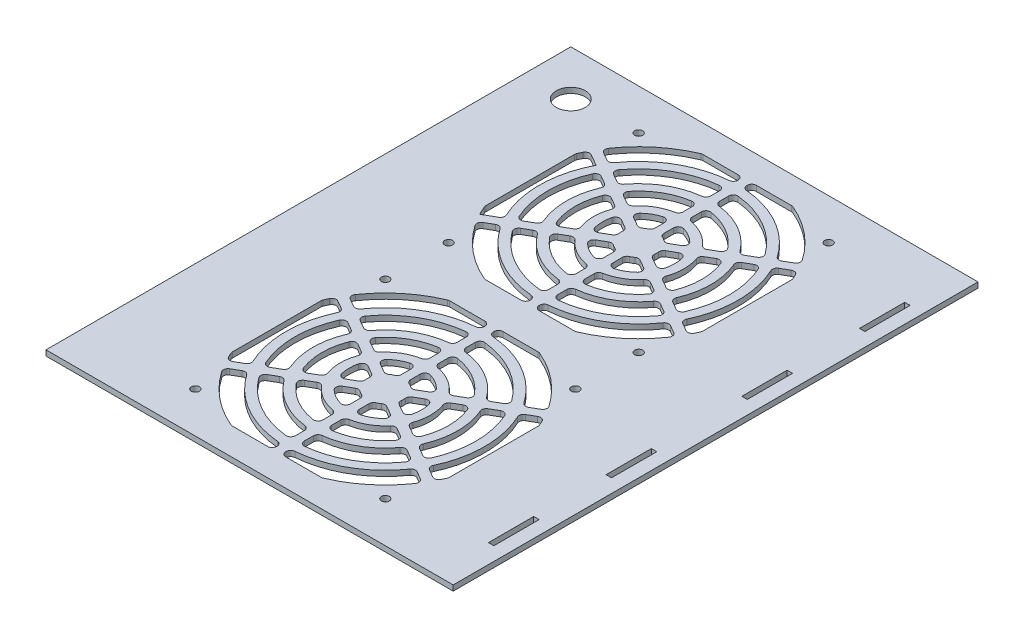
SolidWorks part; units mm, degrees
ref_plane "Front Plane" through (0, 0, 0) normal (0, 0, 1) x (1, 0, 0)
ref_plane "Top Plane" through (0, 0, 0) normal (0, 1, 0) x (1, 0, 0)
ref_plane "Right Plane" through (0, 0, 0) normal (1, 0, 0) x (0, 0, -1)
sketch "Sketch1" plane through (0, 0, 0) normal (0, 1, 0) x (1, 0, 0)
  line L0 (0, 0) -> (0, 290)
  line L1 (0, 290) -> (245, 290)
  line L2 (245, 290) -> (245, 0)
  line L3 (245, 0) -> (0, 0)
extrude "Boss-Extrude1" add sketch "Sketch1" along normal blind 3
sketch "Sketch2" plane through (0, 3, 0) normal (0, 1, 0) x (1, 0, 0)
  line L0 (245, 290) -> (227.5, 290) construction
  line L1 (245, 290) -> (0, 290) construction
  line L2 (227.5, 290) -> (227.5, 260) construction
  line L3 (227.5, 260) -> (227.5, 235) construction
  line L4 (227.5, 235) -> (227.5, 195) construction
  line L5 (227.5, 195) -> (227.5, 170) construction
  line L6 (227.5, 170) -> (227.5, 120) construction
  line L7 (227.5, 120) -> (227.5, 95) construction
  line L8 (227.5, 95) -> (227.5, 55) construction
  line L9 (227.5, 55) -> (227.5, 30) construction
  line L10 (227.5, 30) -> (227.5, 0) construction
  line L11 (0, 0) -> (245, 0) construction
  line L12 (227.5, 260) -> (227.5, 235)
  line L13 (227.5, 235) -> (224.5, 235)
  line L14 (224.5, 235) -> (224.5, 260)
  line L15 (224.5, 260) -> (227.5, 260)
  line L16 (227.5, 195) -> (227.5, 170)
  line L17 (227.5, 170) -> (224.5, 170)
  line L18 (224.5, 170) -> (224.5, 195)
  line L19 (224.5, 195) -> (227.5, 195)
  line L20 (227.5, 120) -> (227.5, 95)
  line L21 (227.5, 95) -> (224.5, 95)
  line L22 (224.5, 95) -> (224.5, 120)
  line L23 (224.5, 120) -> (227.5, 120)
  line L24 (227.5, 30) -> (227.5, 55)
  line L25 (227.5, 55) -> (224.5, 55)
  line L26 (224.5, 55) -> (224.5, 30)
  line L27 (224.5, 30) -> (227.5, 30)
  line L28 (245, 290) -> (235, 290)
  line L29 (235, 290) -> (235, 0)
  line L30 (235, 0) -> (245, 0)
  line L31 (245, 0) -> (245, 290)
  dimension "D1" = 30
  dimension "D2" = 25
  dimension "D3" = 40
  dimension "D4" = 25
  dimension "D5" = 50
  dimension "D6" = 25
  dimension "D7" = 40
  dimension "D8" = 25
extrude "Cut-Extrude1" cut sketch "Sketch2" against normal blind 3
sketch "Sketch4" plane through (0, 3, 0) normal (0, 1, 0) x (1, 0, 0)
  line L0 (0, 290) -> (10, 290)
  line L1 (235, 290) -> (0, 290) construction
  line L2 (10, 290) -> (10, 0)
  line L3 (0, 0) -> (235, 0) construction
  line L4 (10, 0) -> (0, 0)
  line L5 (0, 0) -> (0, 290)
extrude "Cut-Extrude2" cut sketch "Sketch4" against normal blind 10
sketch "Sketch5" plane through (0, 3, 0) normal (0, 1, 0) x (1, 0, 0)
  line L0 (10, 145) -> (235, 145) construction
  line L1 (10, 0) -> (10, 290) construction
  line L2 (235, 290) -> (235, 0) construction
  line L3 (122.5, 135) -> (122.5, 155) construction
  line L4 (122.5, 145) -> (122.5, 135) construction
  line L5 (97.5, 275) -> (147.5, 275)
  line L6 (182.5, 240) -> (182.5, 190)
  line L7 (97.5, 155) -> (147.5, 155)
  line L8 (62.5, 190) -> (62.5, 240)
  line L9 (122.5, 215) -> (122.5, 285.0061) construction
  line L10 (122.5, 155) -> (62.5, 155) construction
  line L11 (62.5, 155) -> (62.5, 275) construction
  line L12 (62.5, 275) -> (182.5, 275) construction
  line L13 (182.5, 275) -> (182.5, 155) construction
  line L14 (182.5, 155) -> (122.5, 155) construction
  line L15 (62.5, 275) -> (70, 275) construction
  line L16 (70, 275) -> (70, 267.5) construction
  line L17 (182.5, 275) -> (182.5, 267.5) construction
  line L18 (182.5, 267.5) -> (175, 267.5) construction
  line L19 (182.5, 155) -> (175, 155) construction
  line L20 (175, 155) -> (175, 162.5) construction
  line L21 (62.5, 155) -> (70, 155) construction
  line L22 (70, 155) -> (70, 162.5) construction
  line L23 (122.5, 285.0061) -> (125, 285.0061)
  line L24 (125, 285.0061) -> (125, 223.0061)
  line L25 (125, 223.0061) -> (122.5, 223.0061)
  line L26 (122.5, 223.0061) -> (120, 223.0061)
  line L27 (120, 223.0061) -> (120, 285.0061)
  line L28 (120, 285.0061) -> (122.5, 285.0061)
  line L29 (183.127, 250.003) -> (184.377, 247.838)
  line L30 (181.877, 252.1681) -> (183.127, 250.003)
  line L31 (128.1835, 221.1681) -> (181.877, 252.1681)
  line L32 (184.377, 247.838) -> (130.6835, 216.838)
  line L33 (175, 162.5) -> (70, 267.5) construction
  line L34 (70, 162.5) -> (175, 267.5) construction
  line L35 (130.6835, 216.838) -> (129.4335, 219.003)
  line L36 (129.4335, 219.003) -> (128.1835, 221.1681)
  line L37 (183.127, 179.997) -> (181.877, 177.8319)
  line L38 (184.377, 182.162) -> (183.127, 179.997)
  line L39 (130.6835, 213.162) -> (184.377, 182.162)
  line L40 (181.877, 177.8319) -> (128.1835, 208.8319)
  line L41 (128.1835, 208.8319) -> (129.4335, 210.997)
  line L42 (129.4335, 210.997) -> (130.6835, 213.162)
  line L43 (122.5, 144.9939) -> (120, 144.9939)
  line L44 (125, 144.9939) -> (122.5, 144.9939)
  line L45 (125, 206.9939) -> (125, 144.9939)
  line L46 (120, 144.9939) -> (120, 206.9939)
  line L47 (120, 206.9939) -> (122.5, 206.9939)
  line L48 (122.5, 206.9939) -> (125, 206.9939)
  line L49 (61.873, 179.997) -> (60.623, 182.162)
  line L50 (63.123, 177.8319) -> (61.873, 179.997)
  line L51 (116.8165, 208.8319) -> (63.123, 177.8319)
  line L52 (60.623, 182.162) -> (114.3165, 213.162)
  line L53 (114.3165, 213.162) -> (115.5665, 210.997)
  line L54 (115.5665, 210.997) -> (116.8165, 208.8319)
  line L55 (61.873, 250.003) -> (63.123, 252.1681)
  line L56 (60.623, 247.838) -> (61.873, 250.003)
  line L57 (114.3165, 216.838) -> (60.623, 247.838)
  line L58 (63.123, 252.1681) -> (116.8165, 221.1681)
  line L59 (116.8165, 221.1681) -> (115.5665, 219.003)
  line L60 (115.5665, 219.003) -> (114.3165, 216.838)
  line L61 (70, 127.5) -> (175, 22.5) construction
  line L62 (175, 127.5) -> (70, 22.5) construction
  line L63 (70, 135) -> (70, 127.5) construction
  line L64 (62.5, 135) -> (70, 135) construction
  line L65 (175, 135) -> (175, 127.5) construction
  line L66 (182.5, 135) -> (175, 135) construction
  line L67 (182.5, 22.5) -> (175, 22.5) construction
  line L68 (182.5, 15) -> (182.5, 22.5) construction
  line L69 (70, 15) -> (70, 22.5) construction
  line L70 (62.5, 15) -> (70, 15) construction
  line L71 (182.5, 135) -> (122.5, 135) construction
  line L72 (182.5, 15) -> (182.5, 135) construction
  line L73 (62.5, 15) -> (182.5, 15) construction
  line L74 (62.5, 135) -> (62.5, 15) construction
  line L75 (122.5, 135) -> (62.5, 135) construction
  line L76 (122.5, 75) -> (122.5, 4.9939) construction
  line L77 (115.5665, 70.997) -> (114.3165, 73.162)
  line L78 (116.8165, 68.8319) -> (115.5665, 70.997)
  line L79 (63.123, 37.8319) -> (116.8165, 68.8319)
  line L80 (114.3165, 73.162) -> (60.623, 42.162)
  line L81 (60.623, 42.162) -> (61.873, 39.997)
  line L82 (61.873, 39.997) -> (63.123, 37.8319)
  line L83 (115.5665, 79.003) -> (116.8165, 81.1681)
  line L84 (114.3165, 76.838) -> (115.5665, 79.003)
  line L85 (60.623, 107.838) -> (114.3165, 76.838)
  line L86 (116.8165, 81.1681) -> (63.123, 112.1681)
  line L87 (63.123, 112.1681) -> (61.873, 110.003)
  line L88 (61.873, 110.003) -> (60.623, 107.838)
  line L89 (122.5, 83.0061) -> (125, 83.0061)
  line L90 (120, 83.0061) -> (122.5, 83.0061)
  line L91 (120, 145.0061) -> (120, 83.0061)
  line L92 (125, 83.0061) -> (125, 145.0061)
  line L93 (125, 145.0061) -> (122.5, 145.0061)
  line L94 (122.5, 145.0061) -> (120, 145.0061)
  line L95 (129.4335, 79.003) -> (130.6835, 76.838)
  line L96 (128.1835, 81.1681) -> (129.4335, 79.003)
  line L97 (181.877, 112.1681) -> (128.1835, 81.1681)
  line L98 (130.6835, 76.838) -> (184.377, 107.838)
  line L99 (184.377, 107.838) -> (183.127, 110.003)
  line L100 (183.127, 110.003) -> (181.877, 112.1681)
  line L101 (129.4335, 70.997) -> (128.1835, 68.8319)
  line L102 (130.6835, 73.162) -> (129.4335, 70.997)
  line L103 (184.377, 42.162) -> (130.6835, 73.162)
  line L104 (128.1835, 68.8319) -> (181.877, 37.8319)
  line L105 (181.877, 37.8319) -> (183.127, 39.997)
  line L106 (183.127, 39.997) -> (184.377, 42.162)
  line L107 (120, 4.9939) -> (122.5, 4.9939)
  line L108 (120, 66.9939) -> (120, 4.9939)
  line L109 (122.5, 66.9939) -> (120, 66.9939)
  line L110 (125, 66.9939) -> (122.5, 66.9939)
  line L111 (125, 4.9939) -> (125, 66.9939)
  line L112 (122.5, 4.9939) -> (125, 4.9939)
  line L113 (62.5, 100) -> (62.5, 50)
  line L114 (97.5, 135) -> (147.5, 135)
  line L115 (182.5, 50) -> (182.5, 100)
  line L116 (97.5, 15) -> (147.5, 15)
  circle A0 centre (70, 162.5) radius 2.2
  circle A1 centre (175, 162.5) radius 2.2
  circle A2 centre (175, 267.5) radius 2.2
  circle A3 centre (70, 267.5) radius 2.2
  circle A10 centre (122.5, 215) radius 10
  circle A11 centre (122.5, 215) radius 20
  circle A12 centre (122.5, 215) radius 25
  circle A13 centre (122.5, 215) radius 35
  circle A15 centre (122.5, 215) radius 40
  circle A16 centre (122.5, 215) radius 50
  circle A18 centre (122.5, 215) radius 55
  circle A20 centre (122.5, 215) radius 65
  circle A21 centre (122.5, 75) radius 65
  circle A22 centre (122.5, 75) radius 55
  circle A23 centre (122.5, 75) radius 50
  circle A24 centre (122.5, 75) radius 40
  circle A25 centre (122.5, 75) radius 35
  circle A26 centre (122.5, 75) radius 25
  circle A27 centre (122.5, 75) radius 20
  circle A28 centre (122.5, 75) radius 10
  circle A29 centre (70, 22.5) radius 2.2
  circle A30 centre (175, 22.5) radius 2.2
  circle A31 centre (175, 127.5) radius 2.2
  circle A32 centre (70, 127.5) radius 2.2
  point P81 (122.5, 215)
  dimension "D1" = 6
extrude "Cut-Extrude3" cut sketch "Sketch5" against normal blind 10 contours L5 A20 L58 A18 L27 | L31 A20 L5 L24 A18 | L39 A20 L6 L32 A18 | L7 A20 L40 A18 L45 | L51 A20 L7 L46 A18 | L57 A20 L8 L52 A18 | L57 A16 L52 A15 | L27 A16 L58 A15 | L31 A16 L24 A15 | L39 A16 L32 A15 | L45 A16 L40 A15 | L51 A16 L46 A15 | L51 A13 L46 A12 | L51 A11 L46 A10 | L57 A11 L52 A10 | L27 A13 L58 A12 | L57 A13 L52 A12 | L31 A13 L24 A12 | L39 A13 L32 A12 | L45 A13 L40 A12 | L45 A11 L40 A10 | L31 A11 L24 A10 | L27 A11 L58 A10 | L39 A11 L32 A10 | A1 | A0 | A3 | A2 | L86 A22 L91 L114 A21 | L92 A22 L97 A21 L114 | L98 A22 L103 A21 L115 | L104 A22 L111 L116 A21 | L108 A22 L79 A21 L116 | L80 A22 L85 A21 L113 | L80 A24 L85 A23 | L86 A24 L91 A23 | L92 A24 L97 A23 | L98 A24 L103 A23 | L104 A24 L111 A23 | L108 A24 L79 A23 | L108 A26 L79 A25 | L104 A26 L111 A25 | L92 A26 L97 A25 | L98 A26 L103 A25 | L86 A26 L91 A25 | L80 A26 L85 A25 | L86 A28 L91 A27 | L80 A28 L85 A27 | L108 A28 L79 A27 | L104 A28 L111 A27 | L98 A28 L103 A27 | L92 A28 L97 A27 | A32 | A31 | A30 | A29
fillet "Fillet1" radius 2.5 98 edges at (120, 1.5, -160.0568) (120, 1.5, -155) (147.5, 1.5, -155) (97.5, 1.5, -155) (76.1678, 1.5, -185.3634) (120, 1.5, -175.0782) (93.5165, 1.5, -195.3796) (67.5, 1.5, -180.359) (80.5029, 1.5, -187.8662) (89.1767, 1.5, -192.874) (106.5653, 1.5, -202.9134) (102.2079, 1.5, -200.3976) (120, 1.5, -190.1253) (125, 1.5, -165.0625) (125, 1.5, -155) (168.8322, 1.5, -185.3634) (155.8233, 1.5, -192.874) (125, 1.5, -160.0568) (125, 1.5, -175.0782) (125, 1.5, -190.1253) (142.7921, 1.5, -200.3976) (125, 1.5, -180.0894) (125, 1.5, -195.1569) (120, 1.5, -205.3175) (125, 1.5, -205.3175) (115.3647, 1.5, -207.9937) (129.6353, 1.5, -207.9937) (138.4347, 1.5, -202.9134) (151.4835, 1.5, -195.3796) (164.4971, 1.5, -187.8662) (177.5, 1.5, -180.359) (180, 1.5, -184.6891) (182.5, 1.5, -190) (182.5, 1.5, -240) (166.9971, 1.5, -192.1963) (153.9835, 1.5, -199.7098) (140.9347, 1.5, -207.2435) (140.9347, 1.5, -222.7565) (171.3322, 1.5, -189.6935) (158.3233, 1.5, -197.2042) (145.2921, 1.5, -204.7277) (132.1353, 1.5, -212.3238) (132.1353, 1.5, -217.6762) (145.2921, 1.5, -225.2723) (153.9835, 1.5, -230.2902) (166.9971, 1.5, -237.8037) (158.3233, 1.5, -232.7958) (171.3322, 1.5, -240.3065) (180, 1.5, -245.3109) (168.8322, 1.5, -244.6366) (155.8233, 1.5, -237.126) (142.7921, 1.5, -229.6024) (138.4347, 1.5, -227.0866) (177.5, 1.5, -249.641) (164.4971, 1.5, -242.1338) (125, 1.5, -264.9375) (125, 1.5, -249.9106) (125, 1.5, -234.8431) (125, 1.5, -224.6825) (125, 1.5, -239.8747) (125, 1.5, -254.9218) (125, 1.5, -269.9432) (125, 1.5, -275) (80.5029, 1.5, -242.1338) (120, 1.5, -254.9218) (120, 1.5, -264.9375) (120, 1.5, -249.9106) (93.5165, 1.5, -234.6204) (106.5653, 1.5, -227.0866) (104.0653, 1.5, -207.2435) (99.7079, 1.5, -225.2723) (86.6767, 1.5, -232.7958) (78.0029, 1.5, -192.1963) (120, 1.5, -234.8431) (112.8647, 1.5, -217.6762) (104.0653, 1.5, -222.7565) (91.0165, 1.5, -230.2902) (78.0029, 1.5, -237.8037) (62.5, 1.5, -240) (62.5, 1.5, -190) (65, 1.5, -245.3109) (120, 1.5, -165.0625) (120, 1.5, -180.0894) (120, 1.5, -195.1569) (73.6678, 1.5, -189.6935) (86.6767, 1.5, -197.2042) (99.7079, 1.5, -204.7277) (112.8647, 1.5, -212.3238) (120, 1.5, -224.6825) (115.3647, 1.5, -222.0063) (102.2079, 1.5, -229.6024) (89.1767, 1.5, -237.126) (76.1678, 1.5, -244.6366) (67.5, 1.5, -249.641) (120, 1.5, -269.9432) (147.5, 1.5, -275) (97.5, 1.5, -275) (120, 1.5, -275)
fillet "Fillet2" radius 2.5 104 edges at (171.3322, 1.5, -100.3065) (125, 1.5, -109.9106) (158.3233, 1.5, -92.7958) (151.4835, 1.5, -94.6204) (158.3233, 1.5, -57.2042) (180, 1.5, -44.6891) (171.3322, 1.5, -49.6935) (180, 1.5, -105.3109) (182.5, 1.5, -50) (182.5, 1.5, -100) (147.5, 1.5, -135) (97.5, 1.5, -135) (125, 1.5, -129.9432) (125, 1.5, -135) (177.5, 1.5, -109.641) (168.8322, 1.5, -104.6366) (164.4971, 1.5, -102.1338) (125, 1.5, -124.9375) (125, 1.5, -114.9218) (155.8233, 1.5, -97.126) (120, 1.5, -135) (120, 1.5, -129.9432) (76.1678, 1.5, -104.6366) (67.5, 1.5, -109.641) (120, 1.5, -124.9375) (120, 1.5, -114.9218) (89.1767, 1.5, -97.126) (120, 1.5, -84.6825) (102.2079, 1.5, -89.6024) (120, 1.5, -99.8747) (120, 1.5, -109.9106) (120, 1.5, -94.8431) (142.7921, 1.5, -89.6024) (125, 1.5, -99.8747) (145.2921, 1.5, -64.7277) (145.2921, 1.5, -85.2723) (153.9835, 1.5, -59.7098) (166.9971, 1.5, -52.1963) (166.9971, 1.5, -97.8037) (153.9835, 1.5, -90.2902) (138.4347, 1.5, -87.0866) (125, 1.5, -94.8431) (140.9347, 1.5, -82.7565) (140.9347, 1.5, -67.2435) (132.1353, 1.5, -77.6762) (129.6353, 1.5, -82.0063) (115.3647, 1.5, -82.0063) (80.5029, 1.5, -102.1338) (93.5165, 1.5, -94.6204) (106.5653, 1.5, -87.0866) (125, 1.5, -84.6825) (132.1353, 1.5, -72.3238) (142.7921, 1.5, -60.3976) (104.0653, 1.5, -82.7565) (91.0165, 1.5, -90.2902) (78.0029, 1.5, -97.8037) (73.6678, 1.5, -49.6935) (65, 1.5, -105.3109) (62.5, 1.5, -100) (62.5, 1.5, -50) (86.6767, 1.5, -57.2042) (73.6678, 1.5, -100.3065) (86.6767, 1.5, -92.7958) (99.7079, 1.5, -85.2723) (99.7079, 1.5, -64.7277) (65, 1.5, -44.6891) (78.0029, 1.5, -52.1963) (91.0165, 1.5, -59.7098) (104.0653, 1.5, -67.2435) (67.5, 1.5, -40.359) (76.1678, 1.5, -45.3634) (120, 1.5, -20.0568) (120, 1.5, -35.0782) (89.1767, 1.5, -52.874) (120, 1.5, -50.1253) (102.2079, 1.5, -60.3976) (112.8647, 1.5, -77.6762) (120, 1.5, -65.3175) (115.3647, 1.5, -67.9937) (129.6353, 1.5, -67.9937) (112.8647, 1.5, -72.3238) (120, 1.5, -55.1569) (120, 1.5, -40.0894) (120, 1.5, -25.0625) (147.5, 1.5, -15) (97.5, 1.5, -15) (120, 1.5, -15) (93.5165, 1.5, -55.3796) (106.5653, 1.5, -62.9134) (125, 1.5, -65.3175) (125, 1.5, -50.1253) (138.4347, 1.5, -62.9134) (125, 1.5, -55.1569) (125, 1.5, -40.0894) (151.4835, 1.5, -55.3796) (164.4971, 1.5, -47.8662) (125, 1.5, -25.0625) (125, 1.5, -35.0782) (155.8233, 1.5, -52.874) (168.8322, 1.5, -45.3634) (177.5, 1.5, -40.359) (80.5029, 1.5, -47.8662) (125, 1.5, -20.0568) (125, 1.5, -15)
sketch "Sketch6" plane through (0, 3, 0) normal (0, 1, 0) x (1, 0, 0)
  line L0 (10, 290) -> (10, 265) construction
  line L1 (10, 0) -> (10, 290) construction
  line L2 (10, 265) -> (35, 265) construction
  circle A0 centre (35, 265) radius 8
extrude "Cut-Extrude4" cut sketch "Sketch6" against normal blind 10
